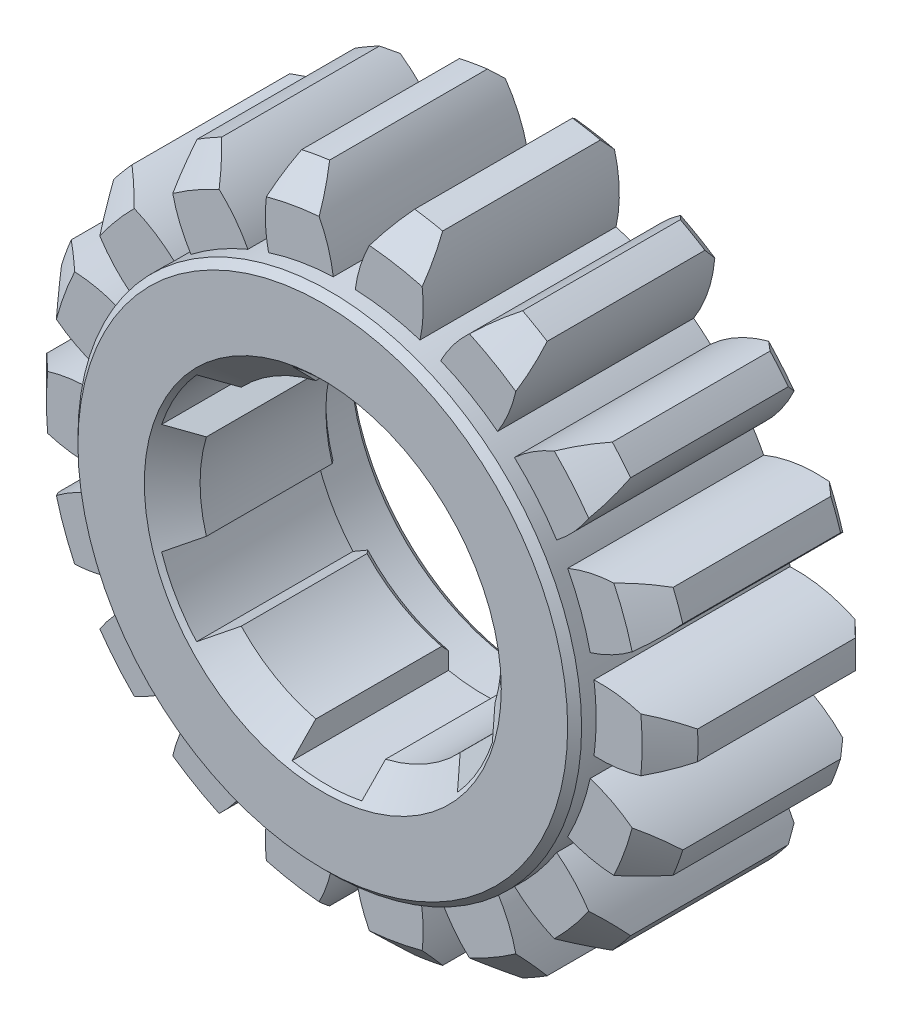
SolidWorks part; units mm, degrees
extrude "Gear Blank" add sketch "Sketch1" along normal mid plane 14.06
sketch "Sketch1" plane through (0, 0, 0) normal (0, 0, 1) x (1, 0, 0)
  circle A0 centre (0, 0) radius 23.36
  dimension "D1" = 46.72
chamfer "Front Gear Chamfer" distance 2 angle 45 1 edges at (23.36, 0, 7.03)
ref_plane "Plane1" through (0, 0, 0) normal (0, 0, 1) x (1, 0, 0)
ref_plane "Plane2" through (0, 0, 0) normal (0, 1, 0) x (-1, 0, 0)
ref_plane "Plane3" through (0, 0, 0) normal (1, 0, 0) x (0, 0, -1)
chamfer "Rear Gear Chamfer" distance 0.75 angle 45 1 edges at (23.36, 0, -7.03)
sketch "Sketch2" plane through (0, 0, 0) normal (0, 0, 1) x (1, 0, 0)
  line L0 (0, 23.36) -> (0, 0) construction
  line L1 (0, 0) -> (9.6524, 0) construction
  line L2 (0, 0) -> (-3.0491, 23.1602) construction
  line L3 (0, 0) -> (3.0491, 23.1602) construction
  line L4 (0, 0) -> (0.7878, 18.0428) construction
  line L5 (0, 0) -> (-0.7878, 18.0428) construction
  arc A1 (3.0491, 23.1602) -> (-3.0491, 23.1602) centre (0, 0) ccw
  arc A2 (3.0491, 23.1602) -> (0.7878, 18.0428) centre (10.7, 16.721) ccw
  arc A3 (-3.0491, 23.1602) -> (-0.7878, 18.0428) centre (-10.7, 16.7209) cw
  arc A4 (-0.7878, 18.0428) -> (0.7878, 18.0428) centre (0, 0) cw
  circle A5 centre (0, 0) radius 23.36 construction
extrude "Tooth Cut" cut sketch "Sketch2" against normal mid plane 14.06
pattern_circular "Tooth Copies" count 18 every 20 about axis through (0, 0, 0) along (0, 0, 1) of "Tooth Cut"
sketch "Sketch3" plane through (0, 0, 7.03) normal (0, 0, 1) x (1, 0, 0)
  circle A0 centre (0, 0) radius 18.06
  arc A1 (5.4308, -17.2241) -> (6.9113, -16.6853) centre (0, 0) ccw construction
extrude "Boss-Extrude1" add sketch "Sketch3" along normal blind 1.54
chamfer "Chamfer1" distance 0.5 angle 45 1 edges at (18.06, 0, 8.57)
sketch "Sketch4" plane through (0, 0, -7.03) normal (0, 0, -1) x (-1, 0, 0)
  circle A0 centre (0, 0) radius 13.1
  arc A1 (6.9113, 16.6853) -> (5.4308, 17.2241) centre (0, 0) ccw construction
  dimension "D1" = 26.2
extrude "Cut-Extrude1" cut sketch "Sketch4" against normal blind 4.08
sketch "Sketch5" plane through (0, 0, -2.95) normal (0, 0, -1) x (-1, 0, 0)
  circle A0 centre (0, 0) radius 10.8
  circle A1 centre (0, 0) radius 13.1 construction
  dimension "D1" = 21.6
extrude "Cut-Extrude2" cut sketch "Sketch5" against normal through all
chamfer "Chamfer2" distance 0.5 angle 45 2 edges at (-13.1, 0, -7.03) (-10.8, 0, -2.95)
chamfer "Chamfer3" distance 2 angle 45 1 edges at (-10.8, 0, 8.57)
sketch "Sketch6" plane through (0, 0, -2.95) normal (0, 0, -1) x (-1, 0, 0)
  line L0 (0, 0) -> (-3.7911, 0) construction
  line L1 (0, 0) -> (0, -12.5) construction
  line L2 (2.5, -12.2474) -> (2.5, -10.5067)
  line L3 (-2.5, -12.2474) -> (-2.5, -10.5067)
  arc A1 (-2.5, -12.2474) -> (2.5, -12.2474) centre (0, 0) ccw
  arc A2 (-2.5, -10.5067) -> (2.5, -10.5067) centre (0, 0) ccw
  circle A6 centre (0, 0) radius 10.8 construction
  dimension "D1" = 25
  dimension "D2" = 90
  dimension "D3" = 5
extrude "One Spline Cut" cut sketch "Sketch6" against normal through all
pattern_circular "Spline Cut Copies" count 6 over 360 about axis through (0, 0, 0) along (0, 0, 1) of "One Spline Cut"
equation "\"D2@Tooth Copies\"=360/\"D1@Tooth Copies\""
equation "\"D4@Sketch2\" = (3/4) * \"D2@Tooth Copies\""
equation "\"D5@Sketch2\"= \"D2@Tooth Copies\" - \"D4@Sketch2\""
equation "\"D1@Sketch2\" = \"D1@Sketch1\" - 10.6"
equation "\"D1@Tooth Cut\" = \"D1@Gear Blank\""
